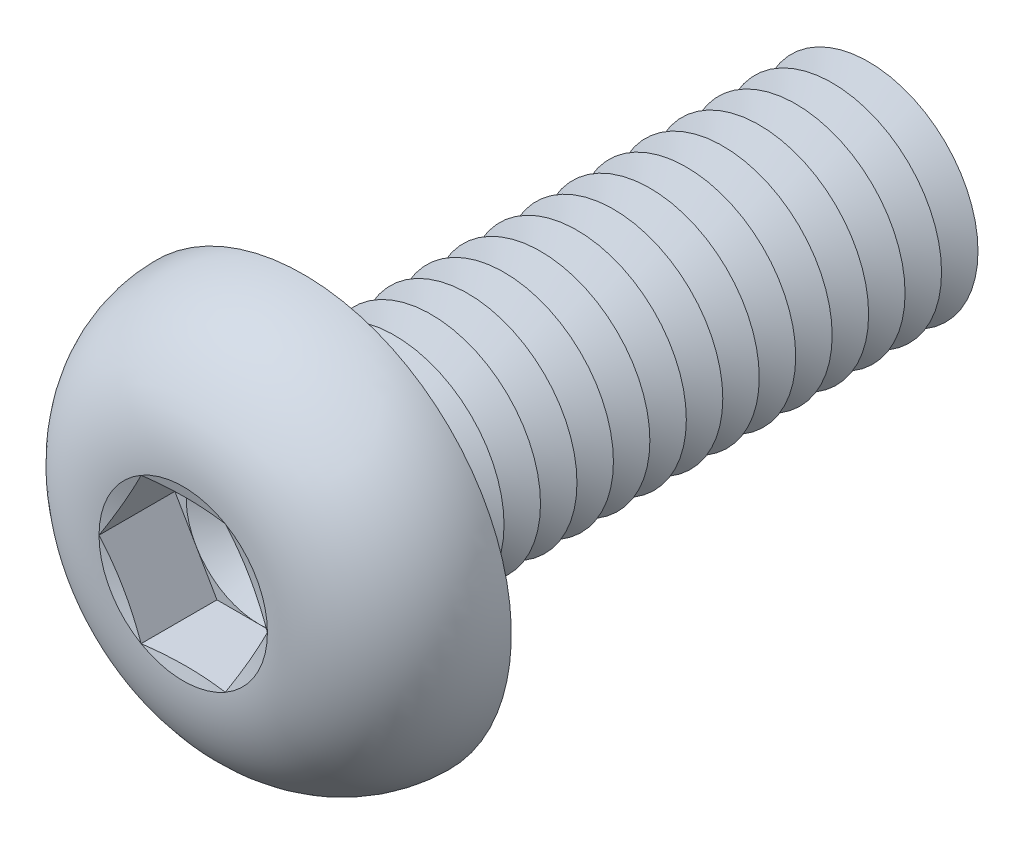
SolidWorks part; units mm, degrees
ref_plane "Front Plane" through (0, 0, 0) normal (0, 0, 1) x (1, 0, 0)
ref_plane "Top Plane" through (0, 0, 0) normal (0, 1, 0) x (1, 0, 0)
ref_plane "Right Plane" through (0, 0, 0) normal (1, 0, 0) x (0, 0, -1)
sketch "Sketch1" plane through (0, 0, 0) normal (1, 0, 0) x (0, 0, -1)
  line L0 (0, 1.5) -> (0, 2.85)
  line L3 (0, 1.5) -> (8, 1.5)
  line L4 (8, 1.5) -> (8, 0)
  line L5 (8, 0) -> (-1.65, 0) construction
  line L6 (-1.65, 0) -> (8, 0)
  line L7 (-1.65, 1.1547) -> (-1.65, 0.5773) construction
  line L8 (-1.65, 0.5773) -> (-1.65, 0)
  line L9 (-1.65, 1.1547) -> (-1.4953, 0.5773)
  line L10 (-1.4953, 0.5773) -> (-1.65, 0.5773)
  line L11 (8, 0) -> (22.7481, 0) construction
  line L12 (0, 2.85) -> (-1.65, 2.85) construction
  arc A1 (0, 2.85) -> (-1.65, 1.1547) centre (0, 1.1994) ccw
  point P8 (8, 0.75)
  dimension "D1" = 5.7
  dimension "D2" = 3
  dimension "D3" = 1.65
  dimension "D4" = 2.3094
  dimension "D5" = 8
  dimension "D6" = 15
revolve "Revolve1" add sketch "Sketch1" angle 360 about L5
fillet "Fillet1" radius 0.25 1 edges at (-1.5, 0, 0)
sketch "Sketch2" plane through (0, 0, 0) normal (1, 0, 0) x (0, 0, -1)
  line L0 (7.75, 1.5) -> (8.25, 1.5)
  line L1 (8, 1.5) -> (0.25, 1.5) construction
  line L2 (8.25, 1.5) -> (8, 1.067)
  line L3 (8, -1.5) -> (8, 1.5) construction
  line L4 (8, 1.067) -> (7.75, 1.5)
  dimension "D1" = 0.5
revolve "Cut-Revolve1" cut sketch "Sketch2" angle 360 about axis through (0, 0, -8) along (0, 0, -1)
pattern_linear "LPattern1" count 16 spacing 0.5 along (0, 0, 1) of "Cut-Revolve1"
sketch "Sketch3" plane through (0, 0, 1.65) normal (0, 0, 1) x (1, 0, 0)
  line L7 (0.5773, 1) -> (-0.5774, 1)
  line L8 (-0.5774, 1) -> (-1.1547, 0)
  line L9 (-1.1547, 0) -> (-0.5773, -1)
  line L10 (-0.5773, -1) -> (0.5773, -1)
  line L11 (0.5773, -1) -> (1.1547, 0)
  line L12 (1.1547, 0) -> (0.5773, 1)
  circle A0 centre (0, 0) radius 1 construction
  circle A3 centre (0, 0) radius 1.1547 construction
extrude "Cut-Extrude1" cut sketch "Sketch3" against normal blind 1.04
sketch "Sketch4" plane through (0, 0, 0.61) normal (0, 0, 1) x (1, 0, 0)
  line L1 (0.5773, 1) -> (-0.5774, 1) construction
  circle A0 centre (0, 0) radius 1
extrude "Cut-Extrude2" cut sketch "Sketch4" against normal through all draft 60
